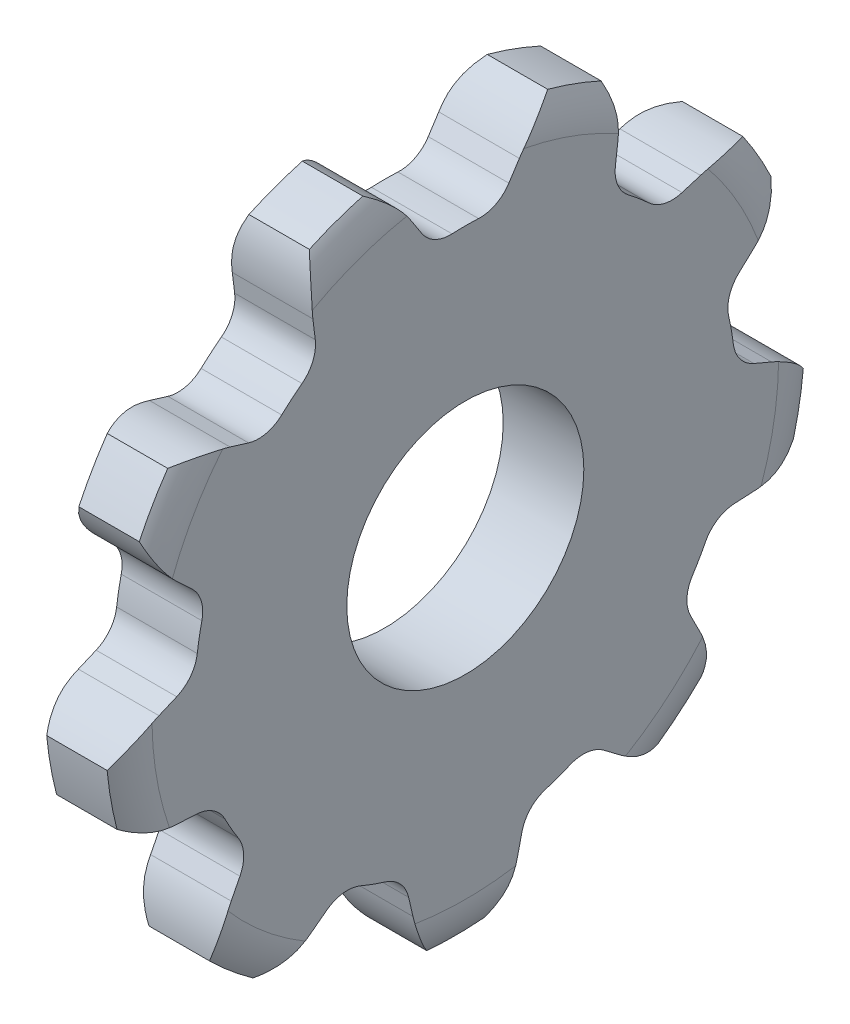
SolidWorks part; units mm, degrees
ref_plane "Plane1" through (0, 0, 0) normal (0, 0, 1) x (1, 0, 0)
ref_plane "Plane2" through (0, 0, 0) normal (0, 1, 0) x (1, 0, 0)
ref_plane "Plane3" through (0, 0, 0) normal (1, 0, 0) x (0, 0, -1)
sketch "Clipboard" plane through (0, 0, 0) normal (0, 1, 0) x (1, 0, 0)
  line L0 (0, 0) -> (22.6789, -3.592)
  line L1 (-15, 0) -> (100, 0) construction
  line L2 (0, 0) -> (-2.1039, 2.3779)
  line L3 (0, 0) -> (-11.863, 4.5341)
  line L4 (0, 0) -> (8.5297, 1.351)
  line L5 (0, 0) -> (-20.9428, -7.811)
  line L6 (0, 0) -> (-7.1589, -4.8301)
  line L7 (-2.1039, 2.3779) -> (2.7074, 24.206)
  line L8 (-76.2, 54.61) -> (-47.9044, 54.61)
  line L9 (-67.0794, 25.4907) -> (-62.6246, 26.5192)
  line L10 (-76.2, 71.12) -> (-42.6324, 71.12)
  circle A0 centre (0, 0) radius 7.9375
  circle A1 centre (0, 0) radius 25.4
  circle A2 centre (0, 0) radius 25.4
  dimension "MHD" = 50.8
  dimension "Hub_dia" = 50.8
  dimension "Num_teeth" = 9
  dimension "Pitch_radius" = 33.5676
  dimension "Pitch" = 22.9616
  dimension "Overall_len" = 22.352
  dimension "Show_teeth" = 9
  dimension "Thickness" = 8.636
  dimension "OAL" = 22.3521
  dimension "T_dim" = 28.2956
  dimension "Ap" = 13
  dimension "H" = 4.572
sketch "BasProSke" plane through (0, 0, 0) normal (0, 1, 0) x (1, 0, 0)
  line L0 (-10, 0) -> (60, 0) construction
  line L1 (0, 0) -> (0, 33.5676)
  line L2 (0, 0) -> (8.636, 0)
  line L3 (8.636, 0) -> (8.636, 33.5676)
  line L4 (7.5565, 37.4538) -> (1.0795, 37.4538)
  arc A0 (0, 33.5676) -> (1.0795, 37.4538) centre (7.5349, 33.5676) cw
  arc A1 (8.636, 33.5676) -> (7.5565, 37.4538) centre (1.1011, 33.5676) ccw
  dimension "D1" = 7.5349
  dimension "G1" = 1.0795
  dimension "G2" = 1.0795
  dimension "H2" = 3.8862
  dimension "Diameter" = 74.9076
  dimension "H1" = 3.8862
  dimension "Thickness" = 8.636
revolve "Base-Revolve" add sketch "BasProSke" angle 360 about L0
sketch "TooCutSke" plane through (0, 0, 0) normal (1, 0, 0) x (0, 0, -1)
  line L0 (-4.6667, 30.5715) -> (-5.7922, 32.3047)
  line L1 (0, 0) -> (0, 107) construction
  line L2 (1.1481, 0) -> (1.1481, 288.74) construction
  line L3 (4.6667, 30.5715) -> (5.7922, 32.3047)
  line L5 (1.1481, 35.3206) -> (42.4634, 8.4901) construction
  arc A0 (1.4197, 28.9104) -> (-1.4197, 28.9104) centre (0, 0) ccw
  arc A1 (1.4197, 28.9104) -> (4.6667, 30.5715) centre (1.5991, 32.5636) ccw
  arc A2 (-1.4197, 28.9104) -> (-4.6667, 30.5715) centre (-1.5991, 32.5636) cw
  circle A3 centre (0, 0) radius 33.5676 construction
  circle A4 centre (1.1481, 33.548) radius 4.572 construction
  arc A5 (5.7922, 32.3047) -> (13.6084, 37.3886) centre (15.4208, 26.0518) cw
  arc A6 (-5.7922, 32.3047) -> (-13.6084, 37.3886) centre (-15.4208, 26.0518) ccw
  arc A7 (13.6084, 37.3886) -> (-13.6084, 37.3886) centre (0, 0) ccw
  dimension "R" = 3.6576
  dimension "Dr" = 28.9453
  dimension "H" = 4.572
  dimension "Pitch_radius" = 33.5676
  dimension "Rt" = 11.4808
  dimension "Ag" = 66
  dimension "Cp" = 1.1481
  dimension "L" = 2.0665
  dimension "Angle" = 40
extrude "ToothCut" cut sketch "TooCutSke" along normal through all
pattern_circular "TeethCuts" count 9 every 40 about axis through (-10, 0, 0) along (1, 0, 0) of "ToothCut"
sketch "HubNeaOneSke" plane through (0, 0, 0) normal (-1, 0, 0) x (0, 0, 1)
  circle A0 centre (0, 0) radius 25.4
  dimension "Diameter" = 50.8
extrude "HubNearOne" [suppressed] add sketch "HubNeaOneSke" along normal blind 13.7161
sketch "HubNeaBotSke" plane through (0, 0, 0) normal (-1, 0, 0) x (0, 0, 1)
  circle A0 centre (0, 0) radius 25.4
  dimension "Diameter" = 50.8
extrude "HubNearBoth" [suppressed] add sketch "HubNeaBotSke" along normal blind 6.858
ref_plane "FarPln" through (8.636, 0, 0) normal (1, 0, 0) x (0, 0, -1)
sketch "HubFarSke" plane through (8.636, 0, 0) normal (1, 0, 0) x (0, 0, -1)
  circle A0 centre (0, 0) radius 25.4
  dimension "Diameter" = 50.8
extrude "HubFar" [suppressed] add sketch "HubFarSke" along normal blind 6.858
sketch "BorSke" plane through (0, 0, 0) normal (1, 0, 0) x (0, 0, -1)
  circle A0 centre (0, 0) radius 12.7
  dimension "Diameter" = 25.4
extrude "Bore" cut sketch "BorSke" along normal mid plane 44.7041
sketch "KeySke" plane through (0, 0, 0) normal (1, 0, 0) x (0, 0, -1)
  line L0 (-3.175, 0) -> (-3.175, 15.5956)
  line L1 (-3.175, 15.5956) -> (3.175, 15.5956)
  line L2 (3.175, 15.5956) -> (3.175, 0)
  line L3 (0, 0) -> (0, 34) construction
  line L4 (-3.175, 0) -> (3.175, 0)
  dimension "Offset" = 15.5956
  dimension "Width" = 6.35
extrude "Keyway" [suppressed] cut sketch "KeySke" along normal mid plane 44.7041
pattern_circular "Keyway2" [suppressed] count 2 every 90 about axis through (-10, 0, 0) along (1, 0, 0)
equation "\"Num_teeth@Clipboard\" = int( \"Num_teeth@Clipboard\" )"
equation "\"Num_teeth@Clipboard\" = ((sgn( \"Num_teeth@Clipboard\" - 5.0)+1)*( \"Num_teeth@Clipboard\" - 5.0))/2 +5.0"
equation "' \"Num_teeth@Clipboard\" = ((sgn( \"Num_teeth@Clipboard\" - 200.0)-1)*( \"Num_teeth@Clipboard\" - 200.0))/-2 +200.0"
equation "\"OAL@Clipboard\" = \"Thickness@Clipboard\""
equation "\"Pitch_radius@Clipboard\" = ( \"Pitch@Clipboard\" / 2.0) / sin(3.14159265 / \"Num_teeth@Clipboard\" )"
equation "\"MHD@Clipboard\" =2.0 * ( \"Pitch_radius@Clipboard\" * 0.9985 -  \"H@Clipboard\" )"
equation "\"MHD@Clipboard\" = ((sgn( \"MHD@Clipboard\" - \"Hub_dia@Clipboard\" )-1)*( \"MHD@Clipboard\" - \"Hub_dia@Clipboard\" ))/-2+ \"Hub_dia@Clipboard\""
equation "\"OAL@Clipboard\" = ((sgn( \"OAL@Clipboard\" - \"Overall_len@Clipboard\" )+1)*( \"OAL@Clipboard\" - \"Overall_len@Clipboard\" ))/2 + \"Overall_len@Clipboard\" + 0.000002"
equation "\"Num_teeth@TeethCuts\" = int( \"Show_teeth@Clipboard\" ) + 1"
equation "\"Num_teeth@TeethCuts\" = ((sgn( \"Num_teeth@TeethCuts\" - \"Num_teeth@Clipboard\" )-1)*( \"Num_teeth@TeethCuts\" - \"Num_teeth@Clipboard\" ))/-2+ \"Num_teeth@Clipboard\""
equation "\"Num_teeth@TeethCuts\" = ((sgn( \"Num_teeth@TeethCuts\" - 2.0)+1)*( \"Num_teeth@TeethCuts\" - 2.0))/2 +2.0"
equation "\"Angle@TeethCuts\" = 360.0 / \"Num_teeth@Clipboard\""
equation "\"Pitch_radius@TooCutSke\" = \"Pitch_radius@Clipboard\""
equation "\"Cp@TooCutSke\" = 0.05 * \"Pitch@Clipboard\""
equation "\"Rt@TooCutSke\" = 0.5 * \"Pitch@Clipboard\""
equation "\"R@TooCutSke\"  = 0.8 * \"H@Clipboard\""
equation "\"Dr@TooCutSke\" = \"Pitch_radius@Clipboard\" * 0.9985 -  \"H@Clipboard\""
equation "\"Ag@TooCutSke\" =  2.0 * \"Ap@Clipboard\" + 360.0 / \"Num_teeth@Clipboard\""
equation "\"L@TooCutSke\" = 0.01 * \"Pitch@Clipboard\" * \"Num_teeth@Clipboard\""
equation "\"H@TooCutSke\" = \"H@Clipboard\""
equation "\"Angle@TooCutSke\" =  360.0 / \"Num_teeth@Clipboard\""
equation "\"Diameter@BasProSke\" = 2.0 * \"Pitch_radius@Clipboard\"  + 1.7 * \"H@Clipboard\""
equation "\"Thickness@BasProSke\"  = \"Thickness@Clipboard\""
equation "\"G1@BasProSke\" =  \"Thickness@Clipboard\" * 0.125"
equation "\"G2@BasProSke\" =   \"Thickness@Clipboard\" * 0.125"
equation "\"H1@BasProSke\" =  \"Diameter@BasProSke\" / 2.0 - \"Pitch_radius@Clipboard\""
equation "\"H2@BasProSke\" =  \"Diameter@BasProSke\" / 2.0 - \"Pitch_radius@Clipboard\""
equation "\"Diameter@HubNeaOneSke\" = \"MHD@Clipboard\""
equation "\"Length@HubNearOne\" = \"OAL@Clipboard\" - \"Thickness@BasProSke\""
equation "\"Diameter@HubNeaBotSke\" = \"MHD@Clipboard\""
equation "\"Length@HubNearBoth\" = ( \"OAL@Clipboard\" - \"Thickness@BasProSke\" ) / 2.0"
equation "\"Thickness@FarPln\" = \"Thickness@BasProSke\""
equation "\"Diameter@HubFarSke\" = \"MHD@Clipboard\""
equation "\"Length@HubFar\" = ( \"OAL@Clipboard\" - \"Thickness@BasProSke\" ) / 2.0"
equation "\"D1@Bore\" = \"OAL@Clipboard\" * 2.0"
equation "\"D1@Keyway\" = \"OAL@Clipboard\" * 2.0"
equation "\"Offset@KeySke\" = \"T_dim@Clipboard\" - \"Diameter@BorSke\" / 2.0"
